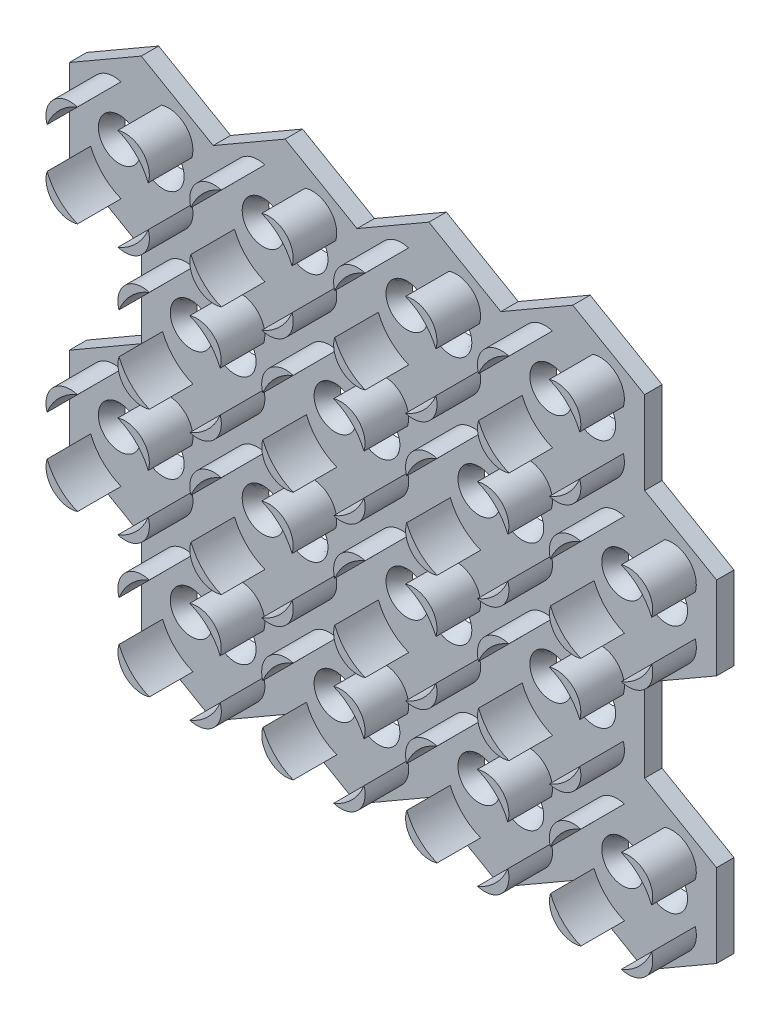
SolidWorks part; units mm, degrees
ref_plane "Front Plane" through (0, 0, 0) normal (0, 0, 1) x (1, 0, 0)
ref_plane "Top Plane" through (0, 0, 0) normal (0, 1, 0) x (1, 0, 0)
ref_plane "Right Plane" through (0, 0, 0) normal (1, 0, 0) x (0, 0, -1)
other "Join1"
other "part2finished<115>@forprintingtop"
other "part2finished<116>@forprintingtop"
other "part2finished<117>@forprintingtop"
other "part2finished<118>@forprintingtop"
other "part2finished<119>@forprintingtop"
other "part2finished<120>@forprintingtop"
other "part2finished<121>@forprintingtop"
other "part2finished<122>@forprintingtop"
other "part2finished<123>@forprintingtop"
other "part2finished<124>@forprintingtop"
other "part2finished<1>@forprintingtop"
other "part2finished<2>@forprintingtop"
other "part2finished<125>@forprintingtop"
other "part2finished<126>@forprintingtop"
other "part2finished<127>@forprintingtop"
other "part2finished<128>@forprintingtop"
